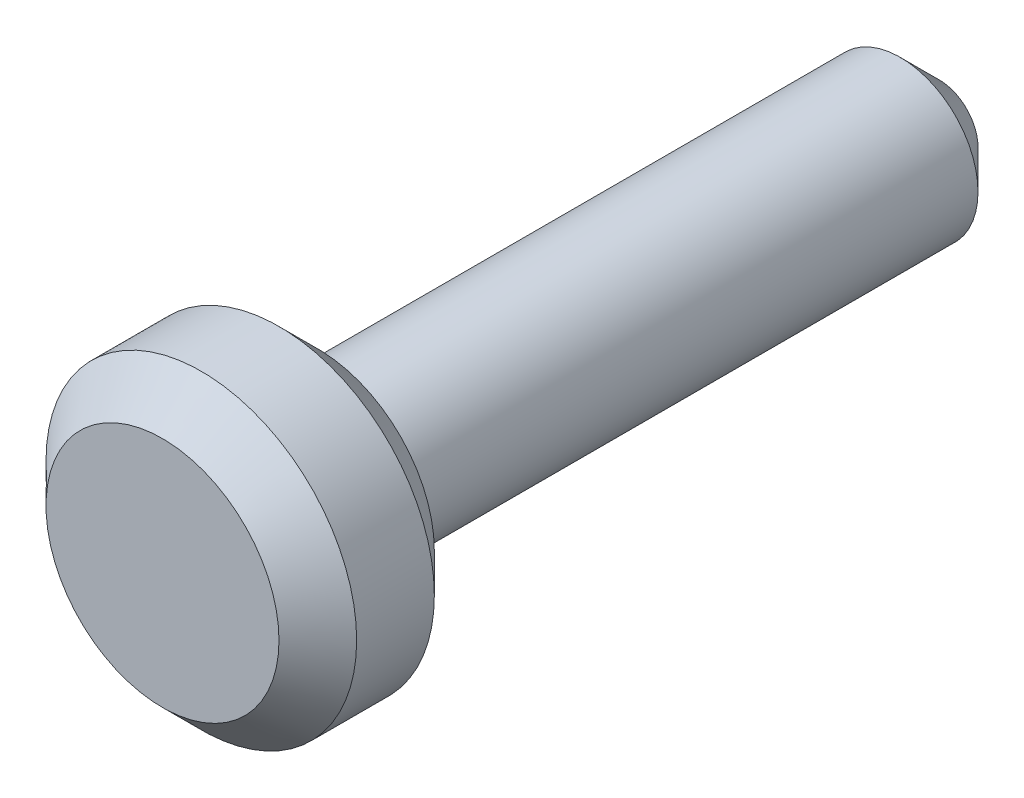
SolidWorks part; units mm, degrees
ref_plane "Face" through (0, 0, 0) normal (0, 0, 1) x (1, 0, 0)
ref_plane "Dessus" through (0, 0, 0) normal (0, 1, 0) x (1, 0, 0)
ref_plane "Droite" through (0, 0, 0) normal (1, 0, 0) x (0, 0, -1)
sketch "Esquisse1" plane through (0, 0, 0) normal (0, 0, 1) x (1, 0, 0)
  circle A0 centre (0, 0) radius 1
  dimension "D1" = 2
extrude "Extrusion1" add sketch "Esquisse1" along normal blind 8
sketch "Esquisse2" plane through (0, 0, 8) normal (0, 0, 1) x (1, 0, 0)
  circle A0 centre (0, 0) radius 2
  dimension "D1" = 4
extrude "Extrusion2" add sketch "Esquisse2" along normal blind 2
chamfer "Chanfrein1" distance 0.5 angle 45
